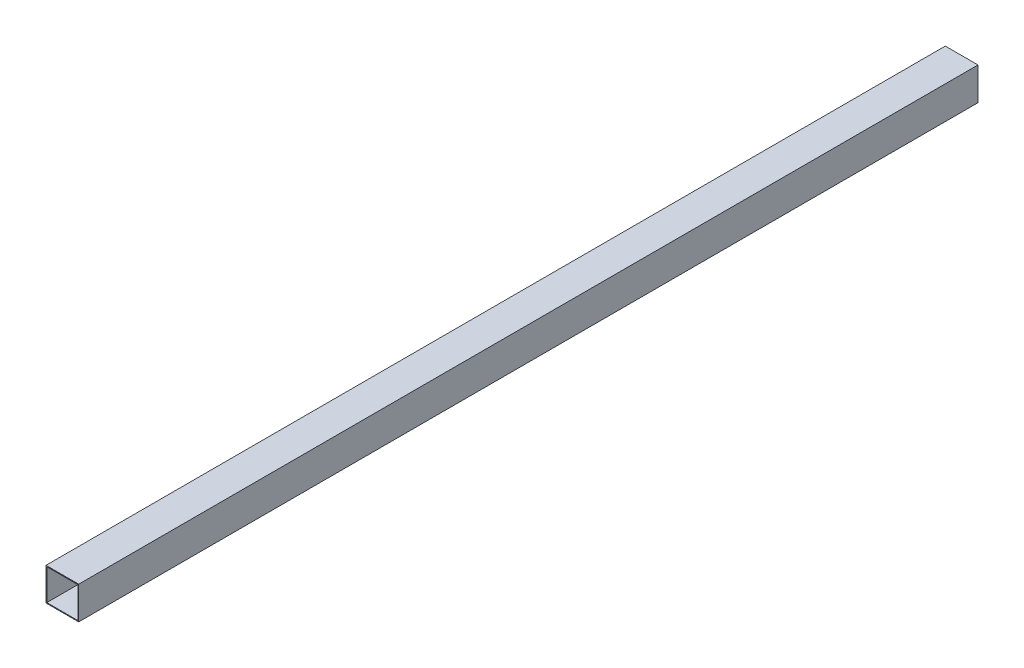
SolidWorks part; units mm, degrees
ref_plane "Piano frontale" through (0, 0, 0) normal (0, 0, 1) x (1, 0, 0)
ref_plane "Piano superiore" through (0, 0, 0) normal (0, 1, 0) x (1, 0, 0)
ref_plane "Piano destro" through (0, 0, 0) normal (1, 0, 0) x (0, 0, -1)
sketch "Schizzo1" plane through (0, 0, 0) normal (0, 0, 1) x (1, 0, 0)
  line L1 (-20, -20) -> (20, -20)
  line L2 (-20, -20) -> (-20, 20)
  line L3 (-20, 20) -> (20, 20)
  line L4 (20, -20) -> (20, 20)
  line L5 (-20, -20) -> (20, 20) construction
  line L6 (-20, 20) -> (20, -20) construction
  point P0 (0, 0)
  dimension "D1" = 40
  dimension "D2" = 40
extrude "Estrusione-Sottile1" add sketch "Schizzo1" along normal blind 1100 thin
